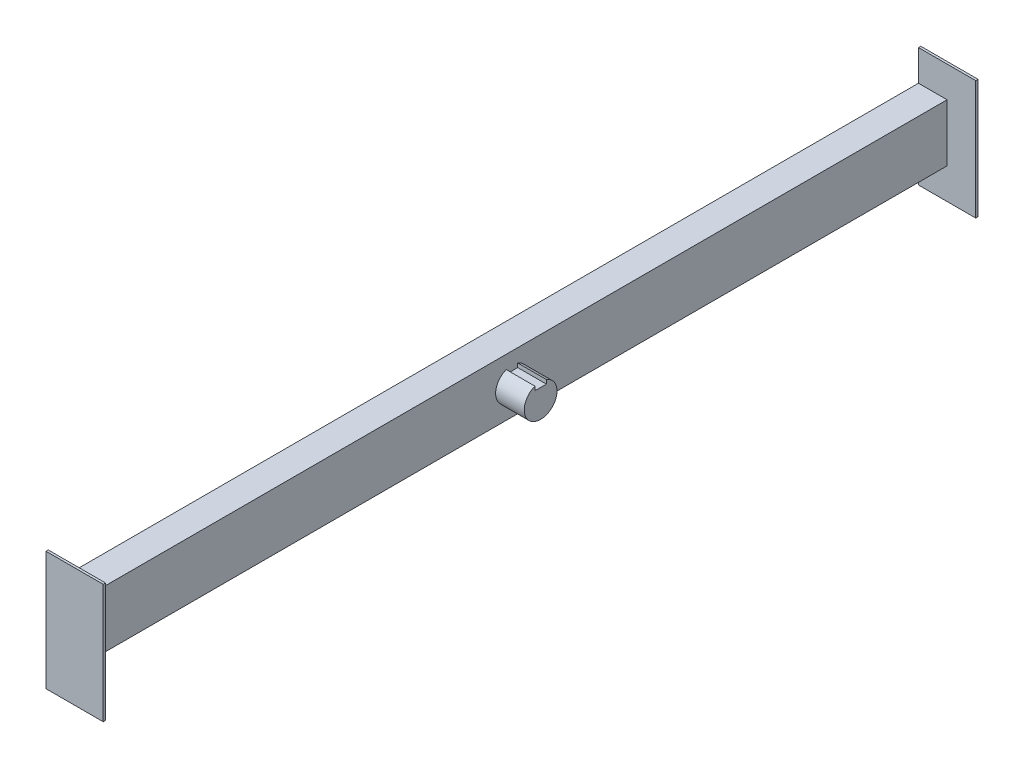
SolidWorks part; units mm, degrees
ref_plane "Plan de face" through (0, 0, 0) normal (0, 0, 1) x (1, 0, 0)
ref_plane "Plan de dessus" through (0, 0, 0) normal (0, 1, 0) x (1, 0, 0)
ref_plane "Plan de droite" through (0, 0, 0) normal (1, 0, 0) x (0, 0, -1)
sketch "Esquisse1" plane through (0, 0, 0) normal (0, 0, 1) x (1, 0, 0)
  line L0 (23, 2) -> (23, 48)
  line L1 (0, 0) -> (25, 0)
  line L2 (0, 0) -> (0, 50)
  line L3 (0, 50) -> (25, 50)
  line L4 (25, 0) -> (25, 50)
  line L5 (2, 48) -> (23, 48)
  line L6 (2, 2) -> (2, 48)
  line L7 (2, 2) -> (23, 2)
  dimension "D1" = 50
  dimension "D2" = 25
  dimension "D3" = 2
extrude "Extrusion1" add sketch "Esquisse1" along normal blind 760
sketch "Esquisse2" plane through (0, 0, 760) normal (0, 0, 1) x (1, 0, 0)
  line L0 (25, 50) -> (0, 50) construction
  line L1 (0, 77) -> (50, 77)
  line L2 (0, 77) -> (0, -27)
  line L3 (0, -27) -> (50, -27)
  line L4 (50, 77) -> (50, -27)
  dimension "D1" = 50
  dimension "D2" = 104
  dimension "D3" = 27
extrude "Extrusion2" add sketch "Esquisse2" along normal blind 2
sketch "Esquisse5" plane through (0, 0, 0) normal (0, 0, -1) x (-1, 0, 0)
  line L1 (-50, 77) -> (0, 77)
  line L2 (-50, 77) -> (-50, -27)
  line L3 (-50, -27) -> (0, -27)
  line L4 (0, 77) -> (0, -27)
extrude "Extrusion3" add sketch "Esquisse5" along normal blind 2
sketch "Esquisse6" plane through (25, 0, 0) normal (1, 0, 0) x (0, 0, -1)
  line L5 (-760, 50) -> (0, 50) construction
  line L6 (-760, 0) -> (-760, 50) construction
  line L9 (-385, 38.3967) -> (-385, 34.9098)
  line L10 (-385, 34.9098) -> (-375, 34.9098)
  line L11 (-375, 38.3967) -> (-375, 34.9098)
  arc A0 (-385, 38.3967) -> (-375, 38.3967) centre (-380, 25) ccw
  dimension "D1" = 25
  dimension "D2" = 380
  dimension "D3" = 10
  dimension "D4" = 5
extrude "Extrusion4" add sketch "Esquisse6" along normal blind 25
